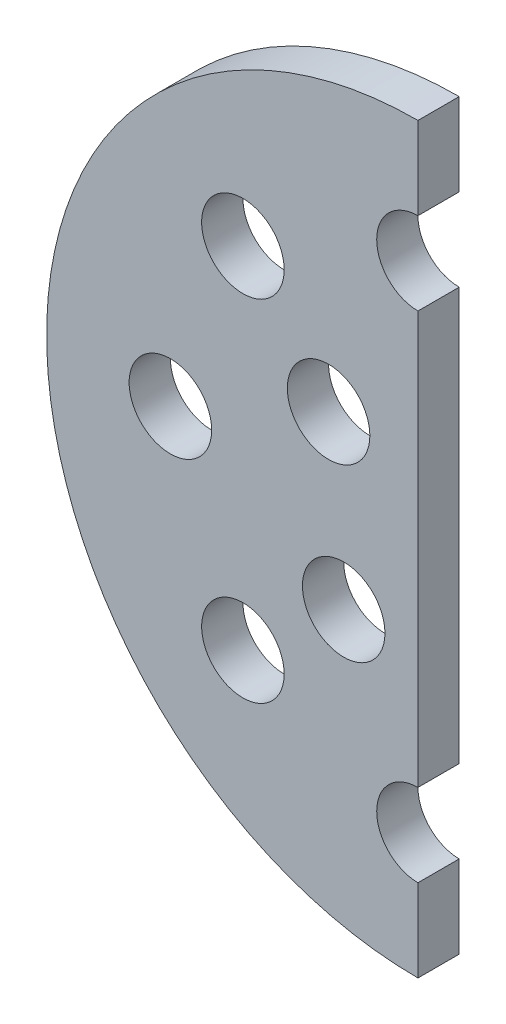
SolidWorks part; units mm, degrees
ref_plane "Front Plane" through (0, 0, 0) normal (0, 0, 1) x (1, 0, 0)
ref_plane "Top Plane" through (0, 0, 0) normal (0, 1, 0) x (1, 0, 0)
ref_plane "Right Plane" through (0, 0, 0) normal (1, 0, 0) x (0, 0, -1)
sketch "Sketch1" plane through (0, 0, 0) normal (0, 0, 1) x (1, 0, 0)
  circle A0 centre (0, 0) radius 275
  circle A1 centre (0, 150) radius 25
  circle A2 centre (106.066, 106.066) radius 25
  circle A3 centre (150, 0) radius 25
  circle A4 centre (106.066, -106.066) radius 25
  circle A5 centre (0, -150) radius 25
  circle A6 centre (-106.066, -106.066) radius 25
  circle A7 centre (-150, 0) radius 25
  circle A8 centre (-106.066, 106.066) radius 25
  circle A9 centre (-54.151, 45) radius 25
  circle A10 centre (45, 54.151) radius 25
  circle A11 centre (54.151, -45) radius 25
  circle A12 centre (-45, -54.151) radius 25
  point P22 (0, 0)
  point P31 (0, 0)
  dimension "D1" = 550
  dimension "D3" = 50
  dimension "D6" = 50
  dimension "D2" = 150
  dimension "D5" = 45
  dimension "D4" = 8
  dimension "D7" = 4
extrude "Boss-Extrude1" add sketch "Sketch1" along normal blind 25
fillet "Fillet1" radius 10 1 edges at (275, 0, 25)
fillet "Fillet2" radius 10 1 edges at (275, 0, 0)
sketch "Sketch2" plane through (0, 0, 0) normal (0, 0, 1) x (1, 0, 0)
  circle A0 centre (0, 0) radius 225
  circle A1 centre (0, 0) radius 336.3332
  dimension "D1" = 450
extrude "Cut-Extrude3" cut sketch "Sketch2" along normal blind 100
sketch "Sketch3" plane through (0, 0, 0) normal (0, 0, 1) x (1, 0, 0)
  line L0 (0, 225) -> (0, -225)
  arc A0 (0, -225) -> (0, 225) centre (0, 0) ccw
extrude "Cut-Extrude4" cut sketch "Sketch3" along normal blind 100
